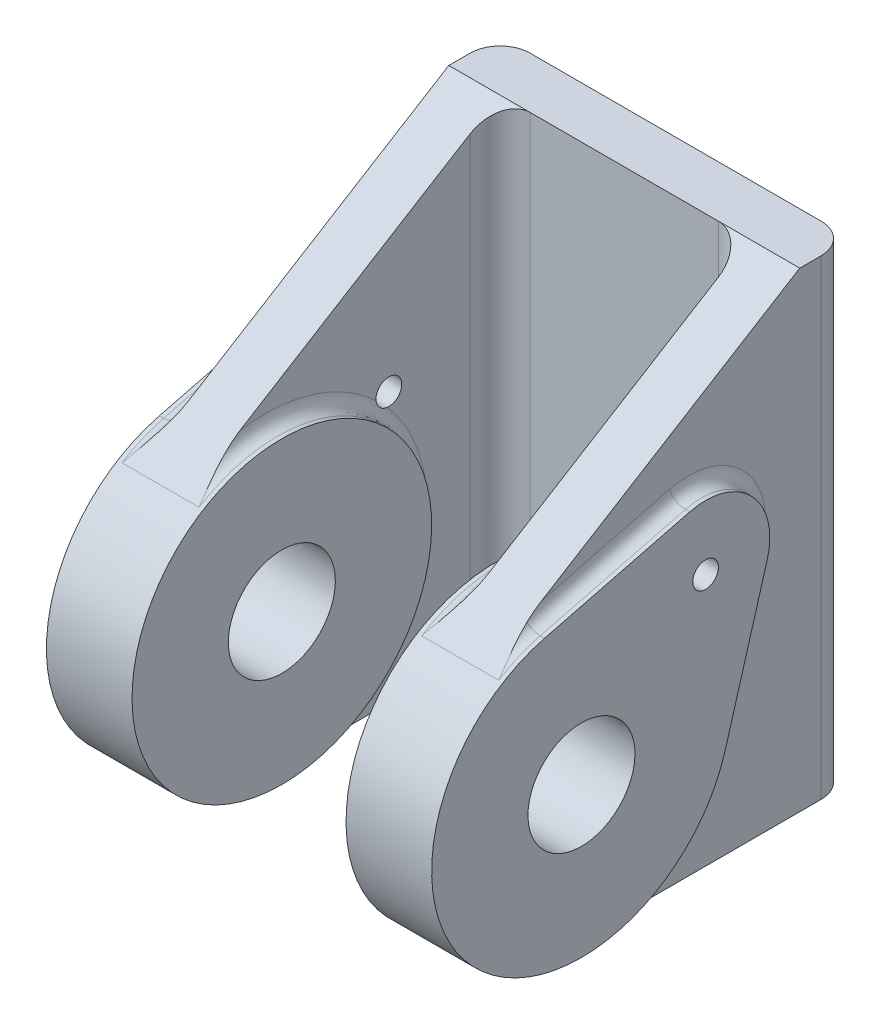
SolidWorks part; units mm, degrees
ref_plane "前视基准面" through (0, 0, 0) normal (0, 0, 1) x (1, 0, 0)
ref_plane "上视基准面" through (0, 0, 0) normal (0, 1, 0) x (1, 0, 0)
ref_plane "右视基准面" through (0, 0, 0) normal (1, 0, 0) x (0, 0, -1)
sketch "草图1" plane through (0, 0, 0) normal (0, 0, 1) x (1, 0, 0)
  line L1 (-41, 55) -> (41, 55)
  line L2 (-41, 55) -> (-41, -55)
  line L3 (-41, -55) -> (41, -55)
  line L4 (41, 55) -> (41, -55)
  dimension "D1" = 82
  dimension "D2" = 110
  dimension "D3" = 41
  dimension "D4" = 55
extrude "拉伸1" add sketch "草图1" along normal blind 12
sketch "草图2" plane through (41, 0, 0) normal (1, 0, 0) x (0, 0, -1)
  line L0 (-12, -55) -> (-67, -55)
  line L1 (-85.3604, 9.7976) -> (-12, 55)
  line L2 (-12, 55) -> (-12, -55)
  arc A0 (-67, -55) -> (-85.3604, 9.7976) centre (-67, -20) cw
  dimension "D1" = 35
  dimension "D2" = 55
extrude "拉伸2" add sketch "草图2" against normal blind 12
sketch "草图3" plane through (41, 0, 0) normal (1, 0, 0) x (0, 0, -1)
  circle A0 centre (-67, -20) radius 35
  dimension "D1" = 70
extrude "拉伸3" add sketch "草图3" along normal blind 4
sketch "草图4" plane through (29, 0, 0) normal (-1, 0, 0) x (0, 0, 1)
  circle A0 centre (67, -20) radius 35
extrude "拉伸4" add sketch "草图4" along normal blind 4
mirror "镜向1" about plane through (0, 0, 0) normal (1, 0, 0) of "拉伸4", "拉伸3", "拉伸2"
sketch "草图5" plane through (41, 0, 0) normal (1, 0, 0) x (0, 0, -1)
  line L0 (0, -55) -> (0, 55) construction
  line L1 (-67, -55) -> (0, -55) construction
  line L2 (-33.4, -29.8) -> (-23.6, 3.8)
  line L3 (-75.6154, 13.9231) -> (-41.6923, 22.5385)
  arc A0 (-23.6, 3.8) -> (-41.6923, 22.5385) centre (-38, 8) ccw
  arc A1 (-67, -55) -> (-85.3604, 9.7976) centre (-67, -20) ccw construction
  arc A2 (-33.4, -29.8) -> (-75.6154, 13.9231) centre (-67, -20) ccw
  dimension "D1" = 30
  dimension "D2" = 38
  dimension "D3" = 63
extrude "拉伸5" add sketch "草图5" along normal blind 4
mirror "镜向2" about plane through (0, 0, 0) normal (1, 0, 0) of "拉伸5"
sketch "草图6" plane through (45, 0, 0) normal (1, 0, 0) x (0, 0, -1)
  circle A0 centre (-38, 8) radius 2
  circle A1 centre (-67, -20) radius 12.5
  dimension "D1" = 4
  dimension "D2" = 25
extrude "切除-拉伸1" cut sketch "草图6" against normal through all
fillet "圆角1" radius 7 4 edges at (41, 0, 0) (-41, 0, 0) (-29, 0, 12)
fillet "圆角2" radius 3 15 edges at (29, -10.4584, 33.3257) (-29, -10.4584, 33.3257) (41, -13, 28.5) (41, 18.4189, 27.209) (41, 18.2308, 58.6538) (-41, -13, 28.5) (-41, 18.4189, 27.209) (-41, 18.2308, 58.6538)
hole_wizard "M6 螺纹孔1" positions "草图8" profile "草图7" tap size "M6" standard "ISO"
sketch "草图8" plane through (45, 0, 0) normal (1, 0, 0) x (0, 0, -1)
  point P1 (-38, 8)
sketch "草图7" plane through (45, 8, 38) normal (0, 1, 0) x (0, 0, -1)
  line L0 (0, 0) -> (0, 90)
  line L1 (0, 90) -> (3, 90)
  line L2 (3, 90) -> (3, 0)
  line L5 (3, 0) -> (0, 0)
  line L11 (0, -6.35) -> (0, 107.95) construction
  dimension "蹟恇盄翋眻噤" = 6
  dimension "籵謂蹟恇謂郰芛旮僅" = 90
